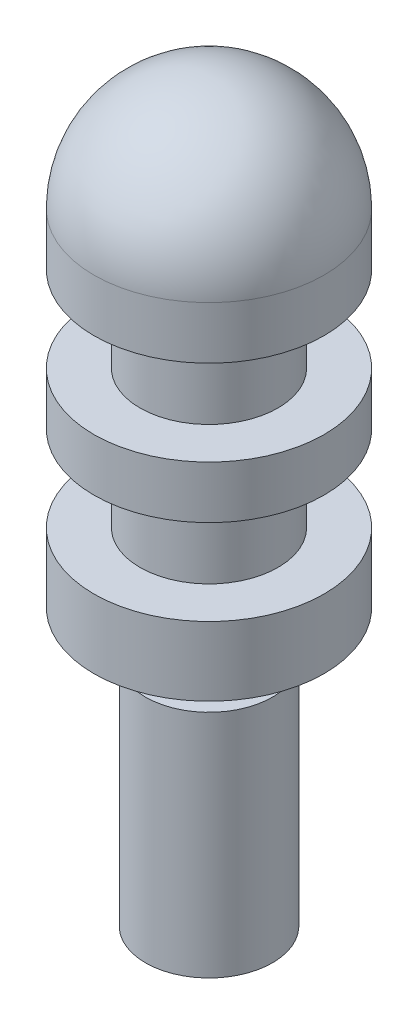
SolidWorks part; units mm, degrees
ref_plane "Front Plane" through (0, 0, 0) normal (0, 0, 1) x (1, 0, 0)
ref_plane "Top Plane" through (0, 0, 0) normal (0, 1, 0) x (1, 0, 0)
ref_plane "Right Plane" through (0, 0, 0) normal (1, 0, 0) x (0, 0, -1)
sketch "Sketch1" plane through (0, 0, 0) normal (0, 0, 1) x (1, 0, 0)
  line L0 (0, 0) -> (0, -14.8234) construction
  line L1 (0, 5.3166) -> (0, 20.32)
  line L2 (-0.3937, 0) -> (-1.7526, 0)
  line L3 (-1.7526, 0) -> (-1.7526, 6.35)
  line L4 (-3.175, 11.8872) -> (-3.175, 13.335)
  line L5 (-3.175, 7.62) -> (-3.175, 9.525)
  line L6 (-3.175, 7.62) -> (-1.2662, 7.62)
  line L7 (-1.2662, 7.62) -> (-1.2662, 6.35)
  line L8 (-1.2662, 6.35) -> (-1.7526, 6.35)
  line L9 (-3.175, 9.525) -> (-1.905, 9.525)
  line L10 (-0.3937, 0) -> (-0.3937, 5.08)
  line L11 (-3.175, 11.8872) -> (-1.905, 11.8872)
  line L12 (-1.905, 9.525) -> (-1.905, 11.8872)
  line L13 (-0.3937, 5.08) -> (0, 5.3166)
  line L14 (-3.175, 15.6972) -> (-3.175, 17.145)
  line L15 (-3.175, 13.335) -> (-1.905, 13.335)
  line L17 (-3.175, 15.6972) -> (-1.905, 15.6972)
  line L18 (-1.905, 13.335) -> (-1.905, 15.6972)
  arc A0 (-3.175, 17.145) -> (0, 20.32) centre (0, 17.145) cw
  dimension "D1" = 6.35
  dimension "D2" = 3.5052
  dimension "D3" = 2.5324
  dimension "D4" = 1.27
  dimension "D5" = 20.32
  dimension "D6" = 12.7
  dimension "D7" = 2.3622
  dimension "D8" = 1.905
  dimension "D9" = 3.81
  dimension "D10" = 59
  dimension "D11" = 0.7874
  dimension "D12" = 5.08
  dimension "D13" = 5.715
revolve "Revolve1" add sketch "Sketch1" angle 360 about L0
